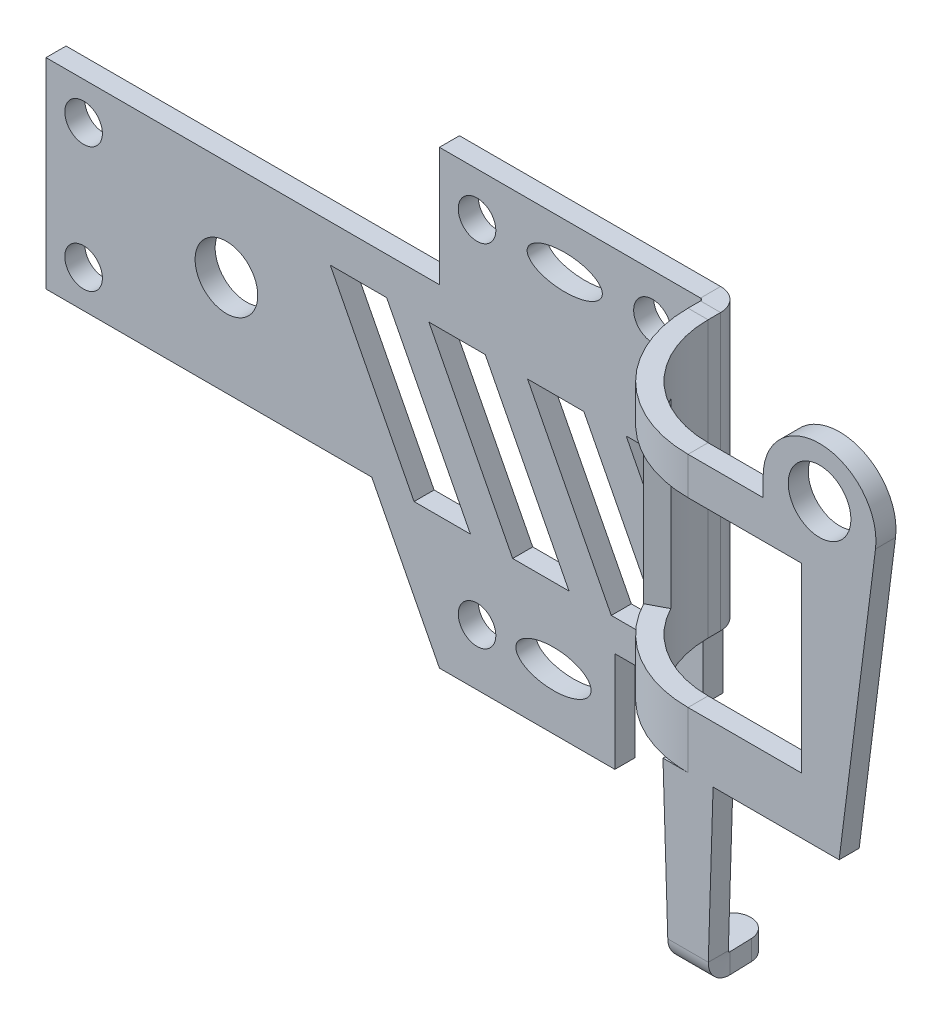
SolidWorks part; units mm, degrees
ref_plane "Plan de face" through (0, 0, 0) normal (0, 0, 1) x (1, 0, 0)
ref_plane "Plan de dessus" through (0, 0, 0) normal (0, 1, 0) x (1, 0, 0)
ref_plane "Plan de droite" through (0, 0, 0) normal (1, 0, 0) x (0, 0, -1)
mirrored part "carter haut_Symétrique"
other "<carter haut>-<Extrusion5>"
